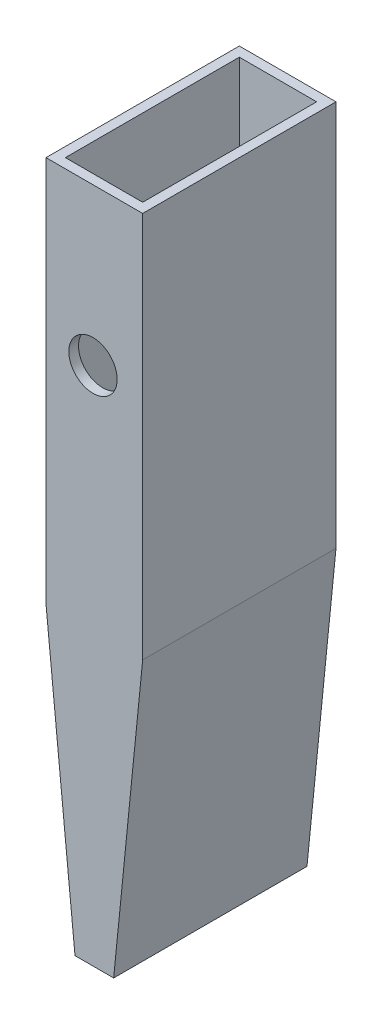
SolidWorks part; units mm, degrees
ref_plane "前视基准面" through (0, 0, 0) normal (0, 0, 1) x (1, 0, 0)
ref_plane "上视基准面" through (0, 0, 0) normal (0, 1, 0) x (1, 0, 0)
ref_plane "右视基准面" through (0, 0, 0) normal (1, 0, 0) x (0, 0, -1)
other "Configuration Table"
sketch "草图1" plane through (0, 0, 0) normal (0, 0, 1) x (1, 0, 0)
  line L0 (0, 0) -> (0, -50) construction
  line L1 (-5, 20) -> (5, 20)
  line L2 (-5, 20) -> (-5, -20)
  line L4 (5, 20) -> (5, -20)
  line L5 (-5, 20) -> (5, -20) construction
  line L6 (-5, -20) -> (5, 20) construction
  line L7 (-5, -20) -> (-2, -50)
  line L8 (-2, -50) -> (2, -50)
  line L9 (5, -20) -> (2, -50)
  point P0 (0, 0)
  dimension "D1" = 40
  dimension "D2" = 10
  dimension "D3" = 2
  dimension "D4" = 30
extrude "凸台-拉伸1" add sketch "草图1" along normal blind 20
shell "抽壳1" thickness 1
sketch "草图2" plane through (0, -50, 0) normal (0, -1, 0) x (1, 0, 0)
  line L8 (-1.7, 0.3) -> (1.7, 0.3)
  line L9 (1.7, 0.3) -> (1.7, 19.7)
  line L10 (1.7, 19.7) -> (-1.7, 19.7)
  line L11 (-1.7, 19.7) -> (-1.7, 0.3)
  line L12 (-1.7, 0.3) -> (1.7, 0.3)
  line L13 (1.7, 0.3) -> (1.7, 19.7)
  line L14 (1.7, 19.7) -> (-1.7, 19.7)
  line L15 (-1.7, 19.7) -> (-1.7, 0.3)
  dimension "D1" = 0.3
sketch "草图3" plane through (0, 0, 20) normal (0, 0, 1) x (1, 0, 0)
  circle A0 centre (-0.1382, 3.8099) radius 2.5
  point P2 (0, 4.7129)
  point P3 (-0.1382, 3.8099)
  dimension "D1" = 5
extrude "切除-拉伸2" cut sketch "草图3" against normal blind 20
